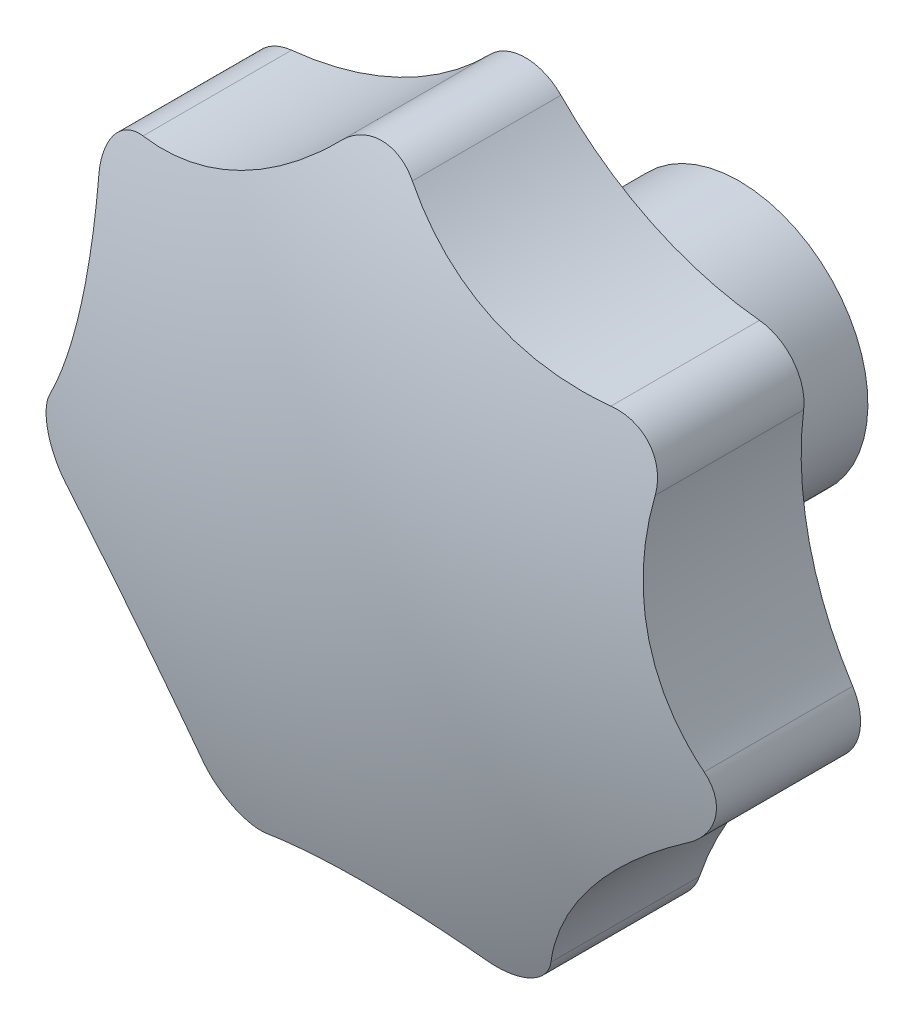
SolidWorks part; units mm, degrees
ref_plane "Front" through (0, 0, 0) normal (0, 0, 1) x (1, 0, 0)
ref_plane "Top" through (0, 0, 0) normal (0, 1, 0) x (1, 0, 0)
ref_plane "Right" through (0, 0, 0) normal (1, 0, 0) x (0, 0, -1)
sketch "Sketch1" plane through (0, 0, 0) normal (1, 0, 0) x (0, 0, -1)
  line L0 (5.969, 0) -> (-5.969, 0)
  line L1 (-5.969, 3.1877) -> (-5.969, 4.5339) construction
  line L4 (-5.969, 3.1877) -> (5.969, 3.1877)
  line L5 (5.969, 3.1877) -> (5.969, 0)
  line L6 (-5.969, 0) -> (-5.969, 3.1877)
  line L7 (-8.5598, 0) -> (-5.969, 0) construction
  line L10 (-5.969, -3.1877) -> (5.969, -3.1877) construction
  dimension "Screw Dia" = 6.3754
  dimension "Screw Length" = 11.938
revolve "Revolve1" add sketch "Sketch1" angle 360 about L7
sketch "Sketch2" plane through (0, 0, 0) normal (1, 0, 0) x (0, 0, -1)
  line L0 (-5.969, 3.1877) -> (-5.969, -3.1877) construction
  line L1 (-5.969, -3.1877) -> (-4.699, -3.1877) construction
  line L2 (-4.699, -3.1877) -> (-5.969, 3.1877) construction
  line L3 (-5.969, 3.1877) -> (-5.8133, 3.2187) construction
  line L4 (-5.8133, 3.2187) -> (-4.7235, 3.4358)
  line L5 (-4.7235, 3.4358) -> (-4.9784, 2.6841)
  line L6 (-4.9784, 2.6841) -> (-5.2898, 2.6221)
  line L7 (-5.2898, 2.6221) -> (-5.8133, 3.2187)
  line L8 (-5.1341, 2.6531) -> (-5.2684, 3.3273) construction
  line L9 (-5.969, 3.1877) -> (-5.2406, 3.1877) construction
  line L10 (-5.2406, 3.1877) -> (-3.9706, -3.1877) construction
  line L11 (-3.9706, -3.1877) -> (-4.699, -3.1877) construction
  line L12 (-5.969, -3.1877) -> (5.969, -3.1877) construction
  line L13 (-5.969, 3.1877) -> (5.969, 3.1877) construction
  line L14 (-5.969, 0) -> (-5.969, 3.1877) construction
  line L15 (-5.969, -0.2716) -> (-3.2422, 0.2716) construction
  point P19 (-4.6056, 0)
  dimension "D1" = 0.1588
  dimension "D2" = 0.3175
  dimension "D3" = 60
  dimension "Thread Pitch" = 1.27
  dimension "D4" = 1.27
revolve "Cut-Revolve1" [suppressed] cut sketch "Sketch2" angle 360 about L15
pattern_linear "LPattern1" [suppressed] count 9 spacing 1.27 along (0, 0, 1) count 2 spacing 1.27 along (0, 0, 1)
sketch "Sketch6" plane through (0, 0, 0) normal (1, 0, 0) x (0, 0, -1)
  line L0 (5.969, 0) -> (5.969, 3.8227)
  line L1 (5.969, 3.8227) -> (-6.604, 3.8227)
  line L2 (-6.604, 3.8227) -> (-6.604, 0)
  line L3 (-6.604, 0) -> (5.969, 0)
  line L4 (-5.969, 3.1877) -> (5.969, 3.1877) construction
  line L5 (-5.969, 0) -> (-5.969, 3.1877) construction
  line L6 (5.969, 0) -> (-6.604, 0) construction
  dimension "D1" = 0.635
  dimension "D2" = 0.635
revolve "Revolve3" add sketch "Sketch6" angle 360 about L6
combine bodies "Combine1" operation type subtract main body 117 bodies to subtract 108
sketch "Sketch4" plane through (0, 0, 0) normal (1, 0, 0) x (0, 0, -1)
  line L0 (5.969, 5.969) -> (5.969, 3.8227)
  line L1 (5.969, 5.969) -> (-3.937, 5.969)
  line L2 (-3.937, 5.969) -> (-3.937, 15.875)
  line L3 (-3.937, 15.875) -> (-10.6045, 15.875)
  line L4 (5.969, 0) -> (-13.462, 0) construction
  line L5 (5.969, 0) -> (5.969, -5.969) construction
  line L6 (-13.462, 0) -> (-13.462, 15.875) construction
  line L7 (-3.937, -5.969) -> (-3.937, -15.875) construction
  line L8 (-13.462, 15.875) -> (-3.937, 15.875) construction
  line L9 (5.969, 0) -> (-13.462, 0) construction
  line L10 (5.969, 0) -> (-13.462, 0) construction
  line L11 (5.969, 3.8227) -> (-6.604, 3.8227)
  line L12 (-6.604, 3.8227) -> (-6.604, 0)
  line L13 (-6.604, 3.8227) -> (-6.604, -3.8227) construction
  line L14 (-6.604, 0) -> (-13.462, 0)
  arc A0 (-13.462, 0) -> (-10.6045, 15.875) centre (32.064, 0) cw
  dimension "D1" = 6.6675
  dimension "D" = 9.906
  dimension "C" = 9.525
  dimension "B" = 11.938
  dimension "A" = 31.75
revolve "Revolve2" add sketch "Sketch4" angle 360 about L4
sketch "Sketch5" plane through (0, 0, 3.937) normal (0, 0, -1) x (-1, 0, 0)
  line L0 (0, 0) -> (0, 15.875) construction
  line L1 (0, 0) -> (-12.4116, 9.8979) construction
  line L2 (-12.4116, 9.8979) -> (-14.7571, 11.7684)
  line L3 (0, 15.875) -> (0, 18.875)
  circle A0 centre (0, 0) radius 15.875 construction
  arc A1 (-1.6407, 15.1842) -> (0, 15.875) centre (0, 13.5811) cw
  circle A2 centre (0, 0) radius 13.4938 construction
  arc A3 (-10.8486, 10.75) -> (-12.4116, 9.8979) centre (-10.6181, 8.4677) ccw
  arc A4 (-10.8486, 10.75) -> (-1.6407, 15.1842) centre (-12.3532, 25.6516) ccw
  arc A5 (-14.7571, 11.7684) -> (0, 18.875) centre (-1.4779, 3.0689) cw
  dimension "D2" = 26.9875
  dimension "D3" = 2.2939
  dimension "D4" = 3
  dimension "D1" = 51.429
extrude "Cut-Extrude1" cut sketch "Sketch5" against normal through all
pattern_circular "CirPattern2" count 7 over 360 about axis through (0, 0, 0) along (0, 0, 1) of "Cut-Extrude1"
fillet "Fillet5" [suppressed] radius 1
fillet "Fillet6" [suppressed] radius 6.35
sketch "Sketch8" [suppressed] plane through (0, 0, 0) normal (1, 0, 0) x (0, 0, -1)
  line L0 (5.969, 3.175) -> (5.4039, 2.6099)
  line L1 (5.4039, 2.6099) -> (5.4039, 0)
  line L2 (5.969, 0) -> (-5.969, 0) construction
  line L3 (5.4039, 0) -> (5.969, 0)
  line L4 (5.969, 0) -> (5.969, 3.175)
  line L5 (5.969, 0) -> (-5.969, 0) construction
  dimension "D1" = 45
revolve "Cut-Revolve2" [suppressed] cut sketch "Sketch8" angle 360 about L5
equation "\"D1@Sketch2\"=\"Thread Pitch@Sketch2\"/8"
equation "\"D2@Sketch2\"=\"Thread Pitch@Sketch2\"/4"
equation "\"D4@Sketch2\"=\"Thread Pitch@Sketch2\""
equation "\"D3@LPattern1\"=\"Thread Pitch@Sketch2\""
equation "\"D4@LPattern1\"=\"Thread Pitch@Sketch2\""
equation "\"D1@LPattern1\"=\"Screw Length@Sketch1\"/\"Thread Pitch@Sketch2\""
equation "\"D2@Sketch5\" = \"A@Sketch4\"*.85"
equation "\"D1@Sketch4\" = \"C@Sketch4\"*.7"
equation "\"D3@Sketch5\" = \"D2@Sketch5\"*.085"
equation "\"D2@Sketch6\" = \"Thread Pitch@Sketch2\"/2"
equation "\"D1@Sketch6\" = \"D2@Sketch6\""
